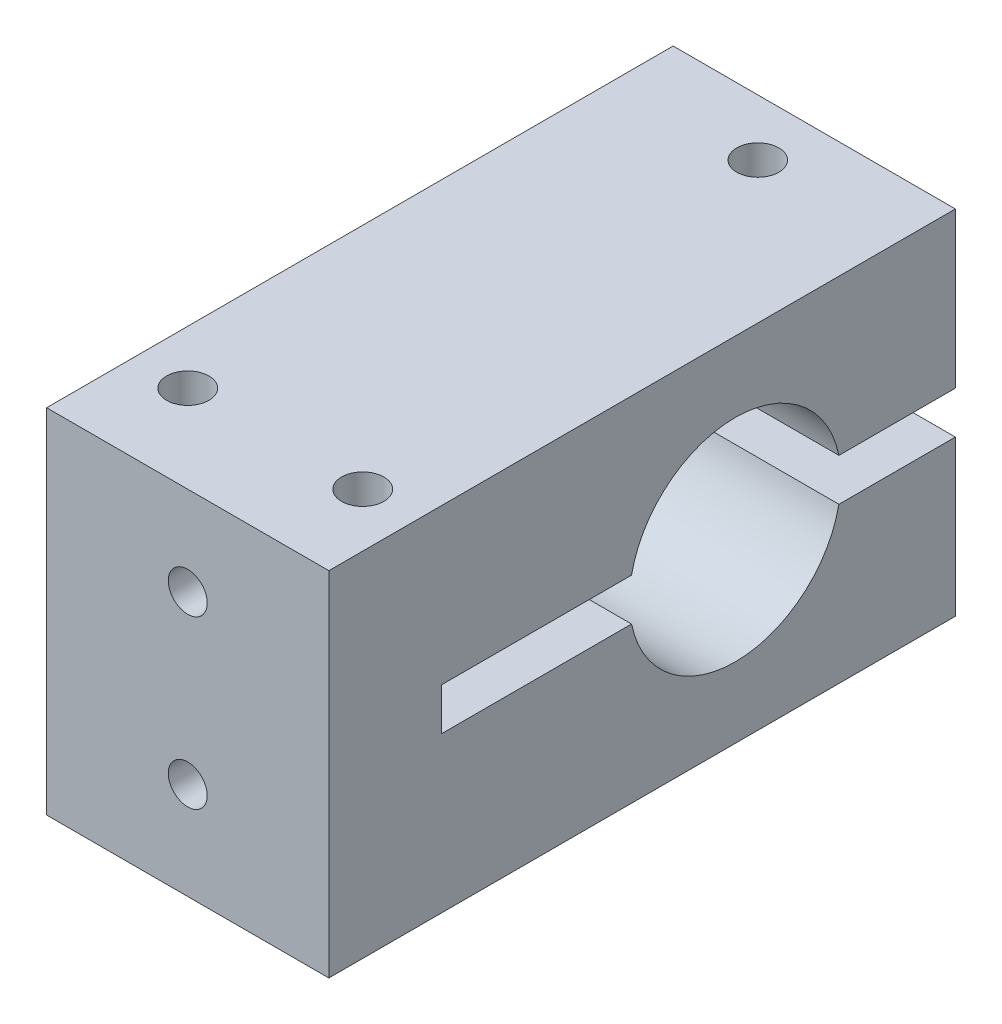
SolidWorks part; units mm, degrees
ref_plane "Front Plane" through (0, 0, 0) normal (0, 0, 1) x (1, 0, 0)
ref_plane "Top Plane" through (0, 0, 0) normal (0, 1, 0) x (1, 0, 0)
ref_plane "Right Plane" through (0, 0, 0) normal (1, 0, 0) x (0, 0, -1)
sketch "Sketch1" plane through (0, 0, 0) normal (0, 1, 0) x (1, 0, 0)
  line L1 (-12.7, 28.194) -> (12.7, 28.194)
  line L2 (-12.7, 28.194) -> (-12.7, -28.194)
  line L3 (-12.7, -28.194) -> (12.7, -28.194)
  line L4 (12.7, 28.194) -> (12.7, -28.194)
  dimension "D1" = 25.4
  dimension "D2" = 56.388
  dimension "D3" = 12.7
  dimension "D4" = 28.194
extrude "Extrude1" add sketch "Sketch1" along normal blind 31.75
sketch "Sketch2" plane through (12.7, 0, 0) normal (1, 0, 0) x (0, 0, -1)
  line L0 (-28.194, 31.75) -> (-28.194, 0) construction
  line L1 (-28.194, 31.75) -> (28.194, 31.75) construction
  circle A0 centre (8.382, 15.875) radius 9.525
  dimension "D1" = 19.05
  dimension "D2" = 36.576
  dimension "D3" = 15.875
extrude "Cut-Extrude1" cut sketch "Sketch2" against normal through all
sketch "Sketch3" plane through (12.7, 0, 0) normal (1, 0, 0) x (0, 0, -1)
  line L0 (-28.194, 31.75) -> (-28.194, 0) construction
  line L1 (32.766, 17.78) -> (-18.034, 17.78)
  line L2 (32.766, 17.78) -> (32.766, 13.97)
  line L3 (32.766, 13.97) -> (-18.034, 13.97)
  line L4 (-18.034, 17.78) -> (-18.034, 13.97)
  line L5 (-28.194, 31.75) -> (28.194, 31.75) construction
  dimension "D1" = 3.81
  dimension "D2" = 50.8
  dimension "D3" = 10.16
  dimension "D4" = 13.97
extrude "Cut-Extrude2" cut sketch "Sketch3" against normal through all
sketch "Sketch5" plane through (0, 31.75, 0) normal (0, 1, 0) x (-1, 0, 0)
  line L0 (7.874, 20.32) -> (-7.874, 20.32) construction
  line L1 (12.7, 28.194) -> (-12.7, 28.194) construction
  line L3 (0, 28.194) -> (0, -4.4225) construction
  circle A0 centre (7.874, 20.32) radius 1.905
  circle A1 centre (-7.874, 20.32) radius 1.905
  point P2 (0, 28.194)
  dimension "D4" = 3.81
  dimension "D5" = 3.81
  dimension "D1" = 15.748
  dimension "D2" = 7.874
  dimension "D3" = 7.874
extrude "Cut-Extrude8" cut sketch "Sketch5" against normal through all
sketch "Sketch6" plane through (0, 0, 28.194) normal (0, 0, 1) x (1, 0, 0)
  line L0 (12.7, 15.875) -> (-12.7, 15.875) construction
  line L1 (12.7, 31.75) -> (12.7, 0) construction
  line L3 (-12.7, 31.75) -> (-12.7, 0) construction
  line L4 (0, 23.749) -> (0, 8.001) construction
  dimension "D1" = 15.748
  dimension "D2" = 7.874
hole_wizard "#6-32 Tapped Hole1" positions "3DSketch1" profile "Sketch7" tap size "#6-32" standard "Ansi Inch"
sketch3d "3DSketch1"
  line L0 (0, 23.749, 28.194) -> (0, 8.001, 28.194) construction
  point P0 (0, 23.749, 28.194)
  point P3 (0, 8.7353, 28.194)
sketch "Sketch7" plane through (0, 23.749, 28.194) normal (1, 0, 0) x (0, -1, 0)
  line L0 (0, 0) -> (0, 17.5767)
  line L1 (0, 17.5767) -> (1.3525, 16.764)
  line L2 (1.3525, 16.764) -> (1.3525, 12.7)
  line L3 (1.3525, 12.7) -> (1.7526, 12.7)
  line L4 (1.7526, 12.7) -> (1.7526, 0)
  line L5 (1.7526, 0) -> (0, 0)
  line L10 (0, 17.5767) -> (-1.3526, 16.764) construction
  line L11 (0, -6.35) -> (0, 107.95) construction
  dimension "Tap Drill Dia." = 2.7051
  dimension "Tap Drill Depth" = 16.764
  dimension "Thread Major Dia." = 3.5052
  dimension "Thread Depth" = 12.7
  dimension "Drill Angle" = 118
sketch "Sketch8" plane through (0, 0, 0) normal (0, -1, 0) x (1, 0, 0)
  line L0 (12.7, -28.194) -> (-12.7, -28.194) construction
  point P0 (0, -23.114)
  dimension "D1" = 5.08
hole_wizard "CBORE for #6 Binding Head Machine Screw1" positions "3DSketch2" profile "Sketch9" counterbore size "#6" standard "Ansi Inch"
sketch3d "3DSketch2"
  point P0 (0, 0, -23.114)
sketch "Sketch9" plane through (0, 0, -23.114) normal (1, 0, 0) x (0, 0, -1)
  line L0 (0, 0) -> (0, 31.75)
  line L1 (0, 31.75) -> (1.8986, 31.75)
  line L3 (1.8986, 31.75) -> (1.8987, 2.2098)
  line L4 (1.8987, 2.2098) -> (3.9688, 2.2098)
  line L5 (3.9688, 2.2098) -> (3.9688, 0)
  line L7 (3.9688, 0) -> (0, 0)
  line L11 (0, -6.35) -> (0, 107.95) construction
  dimension "Thru Hole Dia." = 3.7973
  dimension "Thru Hole Depth" = 31.75
  dimension "C'Bore Dia." = 7.9375
  dimension "C'Bore Depth" = 2.2098
equation "\"D4@Sketch1\" = \"D2@Sketch1\"/2"
equation "\"D3@Sketch1\" = \"D1@Sketch1\"/2"
equation "\"D3@Sketch5\" = \"D1@Sketch5\"/2"
equation "\"D5@Sketch5\" = \"D4@Sketch5\""
equation "\"D2@Sketch6\" = \"D1@Sketch6\"/2"
